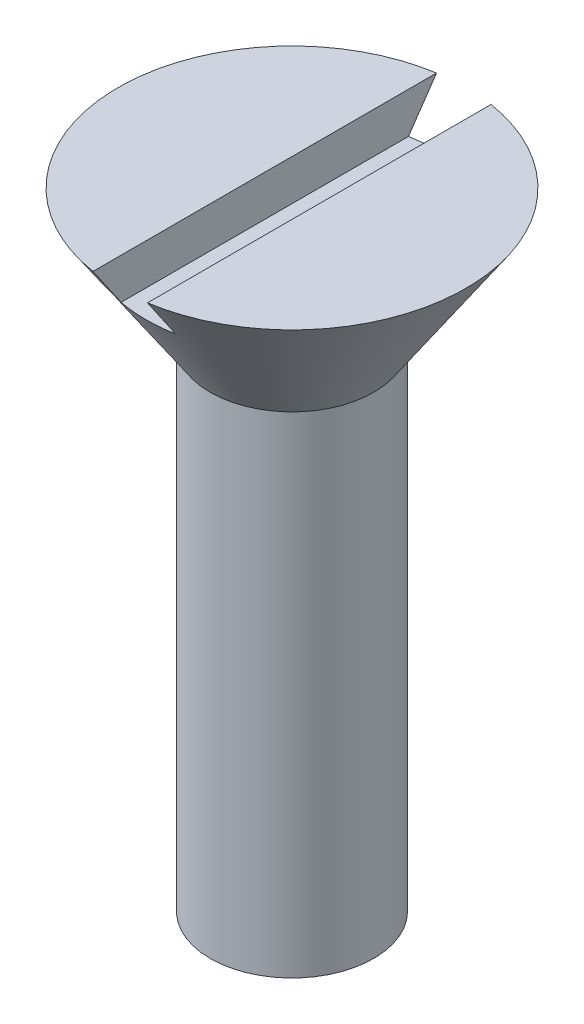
SolidWorks part; units mm, degrees
ref_plane "Front" through (0, 0, 0) normal (0, 0, 1) x (1, 0, 0)
ref_plane "Top" through (0, 0, 0) normal (0, 1, 0) x (1, 0, 0)
ref_plane "Right" through (0, 0, 0) normal (1, 0, 0) x (0, 0, -1)
sketch "Sketch1" plane through (0, 0, 0) normal (0, 0, 1) x (1, 0, 0)
  line L0 (0, 0) -> (0, -27.4912) construction
  line L1 (0, 0) -> (6.385, 0)
  line L2 (6.385, 0) -> (3, -5)
  line L3 (3, -5) -> (3, -23)
  line L4 (3, -23) -> (0, -24.7321)
  line L5 (0, -24.7321) -> (0, 0)
  dimension "D1" = 6
  dimension "D2" = 60
  dimension "D3" = 18
  dimension "D4" = 12.77
  dimension "D5" = 5
revolve "Revolve1" add sketch "Sketch1" angle 360 about L0
sketch "Sketch2" plane through (0, 0, 0) normal (0, 0, 1) x (1, 0, 0)
  line L0 (6.385, 0) -> (-6.385, 0) construction
  line L1 (-1, 0) -> (1, 0)
  line L2 (-1, 0) -> (-1, -1.5)
  line L3 (-1, -1.5) -> (1, -1.5)
  line L4 (1, 0) -> (1, -1.5)
  dimension "D1" = 1.5
  dimension "D2" = 2
extrude "Cut-Extrude1" cut sketch "Sketch2" against normal through all and the other way through all
